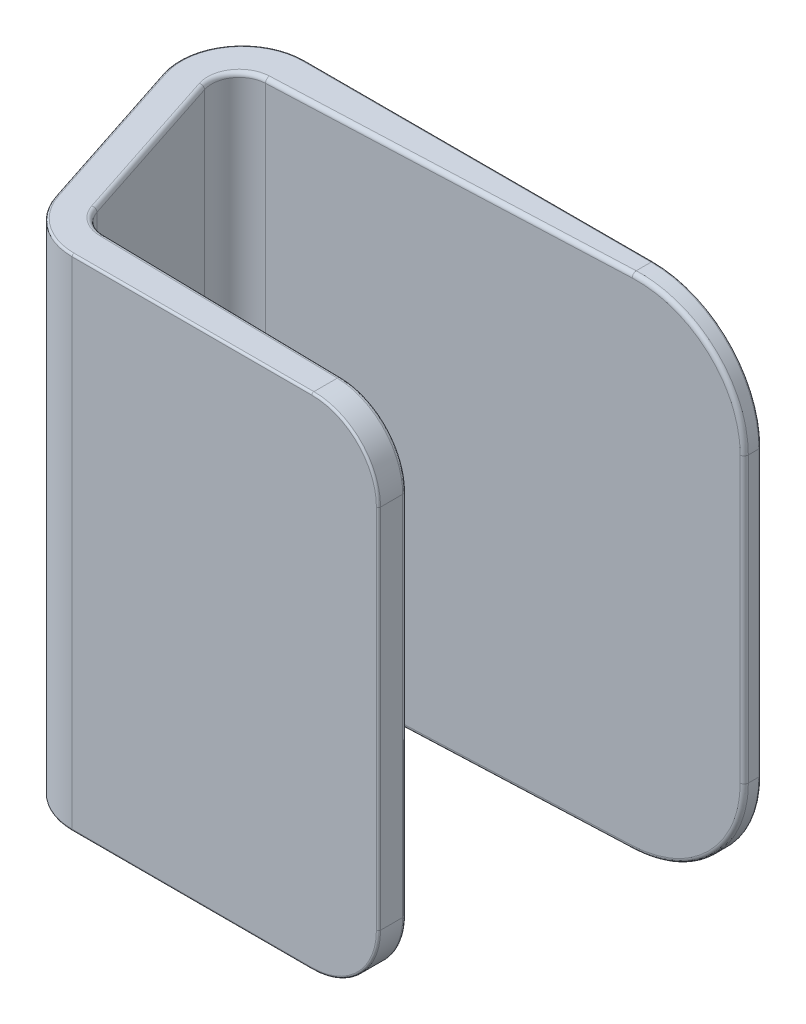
SolidWorks part; units mm, degrees
ref_plane "Front Plane" through (0, 0, 0) normal (0, 0, 1) x (1, 0, 0)
ref_plane "Top Plane" through (0, 0, 0) normal (0, 1, 0) x (1, 0, 0)
ref_plane "Right Plane" through (0, 0, 0) normal (1, 0, 0) x (0, 0, -1)
sketch "Sketch2" plane through (0, 0, 0) normal (0, 1, 0) x (1, 0, 0)
  line L0 (165.4246, 0) -> (0, 0)
  line L1 (0, 0) -> (28.4196, -86.8726)
  line L2 (28.4196, -86.8726) -> (135.6562, -86.8726)
  line L3 (35.4515, -76.3247) -> (135.6562, -78.232)
  line L4 (135.6562, -78.232) -> (135.6562, -86.8726)
  line L5 (35.4515, -76.3247) -> (14.2098, -11.3934)
  line L6 (14.2098, -11.3934) -> (165.4246, -5.068)
  line L7 (165.4246, -5.068) -> (165.4246, 0)
extrude "Boss-Extrude1" add sketch "Sketch2" along normal blind 152.4
fillet "Fillet1" radius 19.05 2 edges at (28.4196, 76.2, 86.8726) (0, 76.2, 0)
fillet "Fillet2" radius 8.382 2 edges at (14.2098, 76.2, 11.3934) (35.4515, 76.2, 76.3247)
fillet "Fillet3" radius 20.32 2 edges at (135.6562, 0, 82.5523) (135.6562, 152.4, 82.5523)
fillet "Fillet4" radius 32.8778 2 edges at (165.4246, 0, 2.534) (165.4246, 152.4, 2.534)
fillet "Fillet5" radius 0.635 16 edges at (129.7046, 146.4484, 86.8726) (78.7836, 152.4, 86.8726) (31.0492, 152.4, 83.2456) (16.1475, 152.4, 49.3594) (10.8525, 152.4, 7.8682) (79.4112, 152.4, 0) (155.795, 142.7703, 0) (165.4246, 76.2, 0) (155.795, 9.6297, 0) (79.4112, 0, 0) (10.8525, 0, 7.8682) (16.1475, 0, 49.3594) (31.0492, 0, 83.2456) (78.7836, 0, 86.8726) (129.7046, 5.9516, 86.8726) (135.6562, 76.2, 86.8726)
fillet "Fillet6" radius 1.27 16 edges at (129.7046, 146.4484, 78.1187) (78.3714, 152.4, 77.1416) (36.5817, 152.4, 74.7966) (25.6252, 152.4, 46.2877) (18.7298, 152.4, 14.5284) (78.9069, 152.4, 8.6871) (155.795, 142.7703, 5.4708) (165.4246, 76.2, 5.068) (155.795, 9.6297, 5.4708) (78.9069, 0, 8.6871) (18.7298, 0, 14.5284) (25.6252, 0, 46.2877) (36.5817, 0, 74.7966) (78.3714, 0, 77.1416) (129.7046, 5.9516, 78.1187) (135.6562, 76.2, 78.232)
